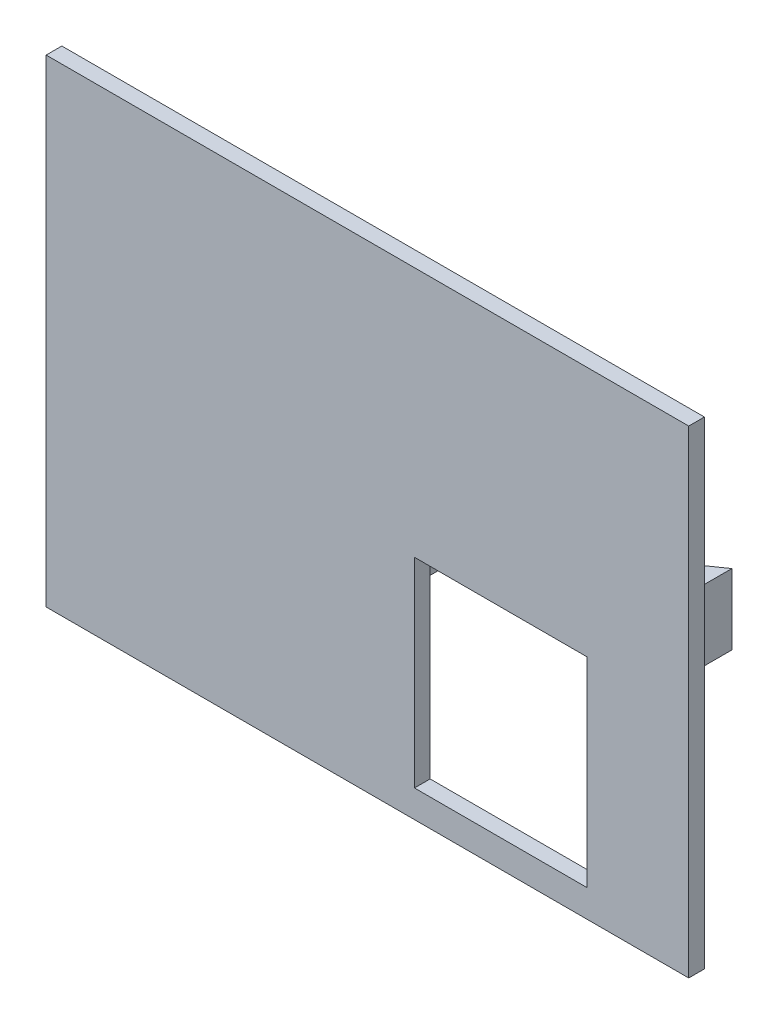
SolidWorks part; units mm, degrees
ref_plane "Alzado" through (0, 0, 0) normal (0, 0, 1) x (1, 0, 0)
ref_plane "Planta" through (0, 0, 0) normal (0, 1, 0) x (1, 0, 0)
ref_plane "Vista lateral" through (0, 0, 0) normal (1, 0, 0) x (0, 0, -1)
sketch "Croquis1" plane through (0, 0, 0) normal (0, 0, 1) x (1, 0, 0)
  line L1 (-47.3837, 38.4675) -> (34.6163, 38.4675)
  line L2 (-47.3837, 38.4675) -> (-47.3837, -22.5325)
  line L3 (-47.3837, -22.5325) -> (34.6163, -22.5325)
  line L4 (34.6163, 38.4675) -> (34.6163, -22.5325)
  dimension "D1" = 61
  dimension "D2" = 82
extrude "Saliente-Extruir1" add sketch "Croquis1" along normal blind 2
sketch "Croquis2" plane through (0, 0, 0) normal (0, 0, -1) x (-1, 0, 0)
  line L0 (-24.6163, 38.4675) -> (-24.6163, -21.7089) construction
  line L1 (-34.6163, 38.4675) -> (47.3837, 38.4675) construction
  line L2 (-34.6163, -22.5325) -> (-34.6163, 38.4675) construction
  line L3 (-34.6163, 18.4675) -> (48.5779, 18.4675) construction
  line L4 (-34.6163, -20.5325) -> (45.4592, -20.5325) construction
  line L5 (47.3837, -22.5325) -> (-34.6163, -22.5325) construction
  line L6 (1.3837, -20.5325) -> (1.3837, 18.4675) construction
  line L7 (-24.6163, -19.0325) -> (1.3837, -19.0325) construction
  line L8 (0.3837, -20.5325) -> (0.3837, -12.2308) construction
  line L9 (0.3837, 6.4675) -> (-24.6163, 6.4675) construction
  line L10 (-21.6163, -19.0325) -> (-21.6163, 6.4675) construction
  line L11 (0.3837, -19.0325) -> (-21.6163, -19.0325)
  line L12 (0.3837, -19.0325) -> (0.3837, 6.4675)
  line L13 (-21.6163, -19.0325) -> (-21.6163, 6.4675)
  line L14 (0.3837, 6.4675) -> (-21.6163, 6.4675)
  point P17 (0.3837, -19.0325)
  dimension "D1" = 10
  dimension "D2" = 2
  dimension "D3" = 39
  dimension "D4" = 26
  dimension "D5" = 1.5
  dimension "D6" = 1
  dimension "D7" = 25.5
  dimension "D8" = 22
extrude "Cortar-Extruir1" cut sketch "Croquis2" against normal blind 2
sketch "Croquis8" plane through (0, 0, 0) normal (0, 0, -1) x (-1, 0, 0)
  line L0 (-24.6163, -22.5325) -> (-24.6163, 16.4675) construction
  line L1 (47.3837, -22.5325) -> (-34.6163, -22.5325) construction
  line L2 (-24.6163, 16.4675) -> (1.3837, 16.4675) construction
  line L3 (1.3837, 16.4675) -> (1.3837, -22.5325) construction
  line L4 (-34.6163, -22.5325) -> (-34.6163, 38.4675) construction
  line L5 (0.3837, -19.0325) -> (0.3837, 6.4675) construction
  line L6 (-34.6163, -20.5325) -> (8.9705, -20.5325) construction
  line L7 (-24.6163, 11.4675) -> (1.3837, 11.4675) construction
  line L8 (-24.6163, 2.4675) -> (1.3837, 2.4675) construction
  line L10 (-24.6163, 2.4675) -> (-26.1163, 2.4675)
  line L11 (-24.6163, 2.4675) -> (-24.6163, 11.4675)
  line L12 (-24.6163, 11.4675) -> (-26.1163, 11.4675)
  line L13 (-26.1163, 2.4675) -> (-26.1163, 11.4675)
  line L14 (1.3837, 2.4675) -> (2.8837, 2.4675)
  line L15 (1.3837, 2.4675) -> (1.3837, 11.4675)
  line L16 (1.3837, 11.4675) -> (2.8837, 11.4675)
  line L17 (2.8837, 2.4675) -> (2.8837, 11.4675)
  dimension "D1" = 10
  dimension "D2" = 39
  dimension "D3" = 1
  dimension "D4" = 2
  dimension "D5" = 5
  dimension "D6" = 14
  dimension "D7" = 9
  dimension "D8" = 1.5
  dimension "D9" = 9
  dimension "D10" = 1.5
extrude "Saliente-Extruir2" add sketch "Croquis8" along normal blind 9
sketch "Croquis9" plane through (0, 0, -9) normal (0, 0, -1) x (-1, 0, 0)
  line L0 (-26.1163, 11.4675) -> (-26.1163, 2.4675)
  line L1 (-26.1163, 11.4675) -> (-21.8163, 11.4675)
  line L2 (-26.1163, 2.4675) -> (-21.8163, 2.4675)
  line L3 (-21.8163, 11.4675) -> (-21.8163, 2.4675)
  line L4 (2.8837, 11.4675) -> (2.8837, 2.4675)
  line L5 (2.8837, 11.4675) -> (-1.4163, 11.4675)
  line L6 (2.8837, 2.4675) -> (-1.4163, 2.4675)
  line L7 (-1.4163, 11.4675) -> (-1.4163, 2.4675)
  line L8 (1.3837, 2.4675) -> (2.8837, 2.4675) construction
  line L9 (2.8837, 2.4675) -> (2.8837, 11.4675) construction
  dimension "D1" = 4.3
  dimension "D2" = 4.3
extrude "Saliente-Extruir3" add sketch "Croquis9" along normal blind 3
sketch "Croquis10" plane through (0, 2.4675, 0) normal (0, -1, 0) x (1, 0, 0)
  line L0 (26.1163, -12) -> (21.8163, -9)
  line L1 (21.8163, -9) -> (21.8163, -12)
  line L2 (21.8163, -12) -> (26.1163, -12)
  line L3 (1.4163, -9) -> (-2.8837, -12)
  line L4 (-2.8837, -12) -> (1.4163, -12)
  line L5 (1.4163, -12) -> (1.4163, -9)
extrude "Cortar-Extruir2" cut sketch "Croquis10" against normal blind 9
